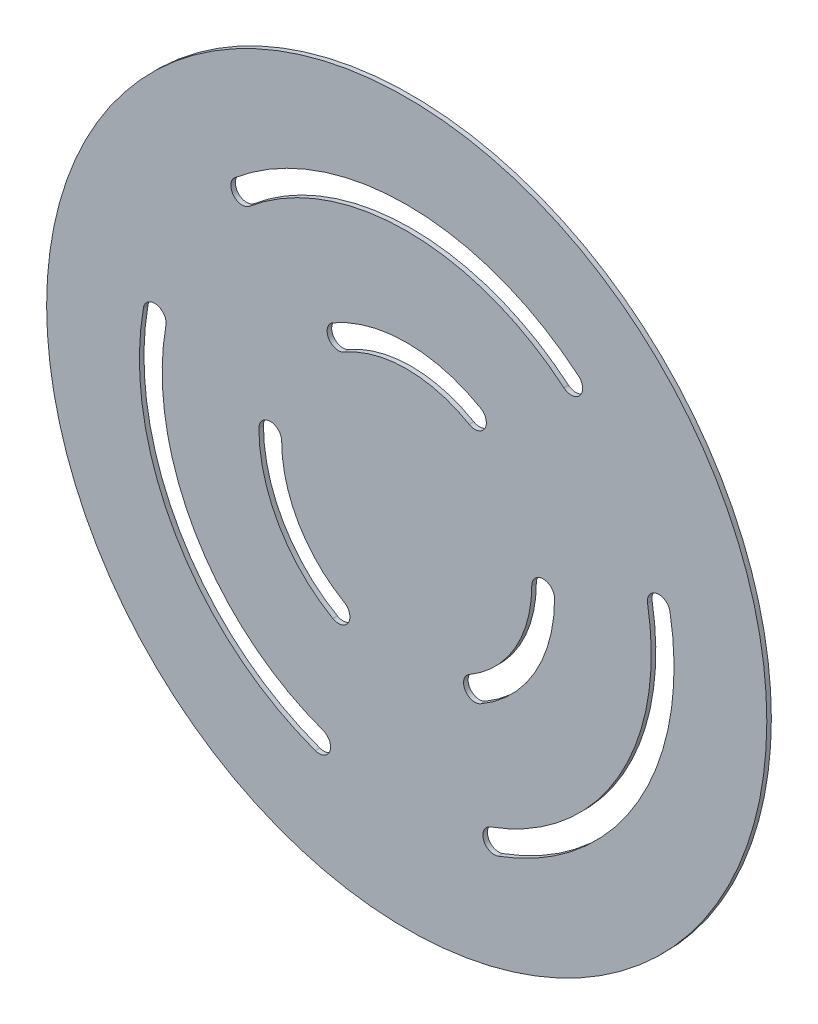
SolidWorks part; units mm, degrees
ref_plane "Front Plane" through (0, 0, 0) normal (0, 0, 1) x (1, 0, 0)
ref_plane "Top Plane" through (0, 0, 0) normal (0, 1, 0) x (1, 0, 0)
ref_plane "Right Plane" through (0, 0, 0) normal (1, 0, 0) x (0, 0, -1)
sketch "Sketch1" plane through (0, 0, 0) normal (0, 0, 1) x (1, 0, 0)
  circle A0 centre (0, 0) radius 158
  dimension "D1" = 316
extrude "Boss-Extrude1" add sketch "Sketch1" along normal blind 2
sketch "Sketch2" plane through (0, 0, 2) normal (0, 0, 1) x (1, 0, 0)
  line L0 (0, 0) -> (-29.9356, 51.8501) construction
  line L1 (29.9356, 51.8501) -> (0, 0) construction
  line L2 (0, 0) -> (0, 59.8713) construction
  line L3 (0, 0) -> (72.1814, 86.0224) construction
  line L4 (0, 0) -> (-72.1814, 86.0224) construction
  line L5 (0, 0) -> (0, 112.2943) construction
  circle A0 centre (0, 0) radius 59.8713 construction
  circle A1 centre (0, 0) radius 112.2943 construction
  arc A2 (-29.9356, 51.8501) -> (29.9356, 51.8501) centre (0, 0) cw construction
  arc A3 (32.4356, 56.1802) -> (-32.4356, 56.1802) centre (0, 0) ccw
  arc A4 (27.4356, 47.5199) -> (-27.4356, 47.5199) centre (0, 0) ccw
  arc A5 (27.4356, 47.5199) -> (32.4356, 56.1802) centre (29.9356, 51.8501) ccw
  arc A6 (-32.4356, 56.1802) -> (-27.4356, 47.5199) centre (-29.9356, 51.8501) ccw
  arc A7 (-72.1814, 86.0224) -> (72.1814, 86.0224) centre (0, 0) cw construction
  arc A8 (75.3953, 89.8527) -> (-75.3953, 89.8527) centre (0, 0) ccw
  arc A9 (68.9675, 82.1922) -> (-68.9675, 82.1922) centre (0, 0) ccw
  arc A10 (68.9675, 82.1922) -> (75.3953, 89.8527) centre (72.1814, 86.0224) ccw
  arc A11 (-75.3953, 89.8527) -> (-68.9675, 82.1922) centre (-72.1814, 86.0224) ccw
  point P7 (0, 59.8713)
  point P18 (0, 112.2943)
  dimension "D1" = 60
  dimension "D2" = 5
  dimension "D3" = 80
  dimension "D4" = 5
extrude "Cut-Extrude1" cut sketch "Sketch2" against normal blind 10
pattern_circular "CirPattern1" count 3 over 360 about axis through (0, 0, 0) along (0, 0, 1) of "Cut-Extrude1"
